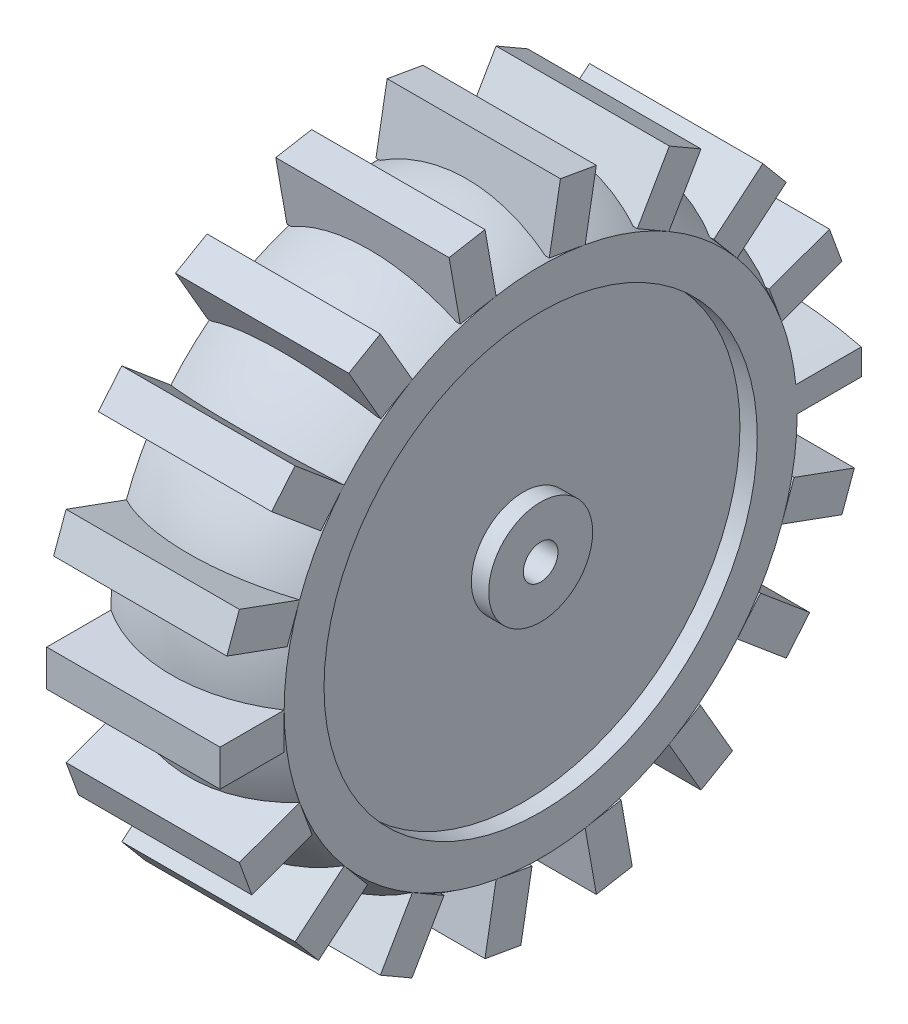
SolidWorks part; units mm, degrees
ref_plane "Front Plane" through (0, 0, 0) normal (0, 0, 1) x (1, 0, 0)
ref_plane "Top Plane" through (0, 0, 0) normal (0, 1, 0) x (1, 0, 0)
ref_plane "Right Plane" through (0, 0, 0) normal (1, 0, 0) x (0, 0, -1)
sketch "Sketch1" plane through (0, 0, 0) normal (1, 0, 0) x (0, 0, -1)
  circle A0 centre (0, 0) radius 35
  dimension "D1" = 70
extrude "Boss-Extrude1" add sketch "Sketch1" along normal blind 20
sketch "Sketch2" plane through (20, 0, 0) normal (1, 0, 0) x (0, 0, -1)
  circle A0 centre (0, 0) radius 2
  dimension "D1" = 4
extrude "Cut-Extrude1" cut sketch "Sketch2" against normal blind 20
sketch "Sketch3" plane through (0, 0, 0) normal (0, 0, 1) x (1, 0, 0)
  line L0 (20, 35) -> (0, 35) construction
  line L1 (-6.5877, 0) -> (24.1886, 0)
  line L2 (0, 35) -> (20, 35)
  arc A0 (0, 35) -> (20, 35) centre (10, 27.5) cw
  point P0 (10, 40)
  point P12 (10, 40)
  dimension "D1" = 5
revolve "Revolve1" add sketch "Sketch3" angle 360 about L1
sketch "Sketch10" plane through (0, 0, 0) normal (-1, 0, 0) x (0, 0, 1)
  circle A0 centre (0, 0) radius 25
  circle A1 centre (0, 0) radius 6
  dimension "D1" = 50
  dimension "D2" = 12
extrude "Cut-Extrude2" cut sketch "Sketch10" against normal blind 2
sketch "Sketch11" plane through (20, 0, 0) normal (1, 0, 0) x (0, 0, -1)
  circle A1 centre (0, 0) radius 6
  circle A2 centre (0, 0) radius 6
  circle A3 centre (0, 0) radius 25
  circle A4 centre (0, 0) radius 25
  dimension "D1" = 0
  dimension "D2" = 0
extrude "Cut-Extrude3" cut sketch "Sketch11" against normal blind 2
sketch "Sketch12" plane through (20, 0, 0) normal (1, 0, 0) x (0, 0, -1)
  circle A0 centre (0, 0) radius 32.6
  circle A2 centre (0, 0) radius 40
  point P4 (-32.6, 0)
  point P5 (-40, 0)
  dimension "D1" = 7.4
extrude "Cut-Extrude4" cut sketch "Sketch12" against normal blind 30
sketch "Sketch13" plane through (0, 0, 0) normal (0, 1, 0) x (1, 0, 0)
  line L0 (0, 32.6) -> (0, -32.6) construction
  line L1 (20, -32.6) -> (20, 32.6) construction
  line L2 (20, 32.6) -> (0, 32.6) construction
  line L3 (0, 29.6) -> (0, 39.0141)
  line L4 (0, 39.0141) -> (20, 39.0141)
  line L5 (20, 39.0141) -> (20, 29.6)
  line L6 (-7.8858, 0) -> (24.909, 0)
  arc A0 (0, 29.6) -> (20, 29.6) centre (10, 14.4333) cw
  point P0 (0, 29.6)
  point P1 (20, 29.6)
  point P4 (10, 32.6)
  dimension "D1" = 3
  dimension "D2" = 3
revolve "Cut-Revolve1" cut sketch "Sketch13" angle 360 about L6
ref_plane "Plane1" through (0, 0, -27) normal (0, 0, 1) x (1, 0, 0)
sketch "Sketch14" plane through (0, 0, -27) normal (0, 0, 1) x (1, 0, 0)
  line L0 (20, -29.6) -> (20, 29.6) construction
  line L1 (0, 29.6) -> (0, -29.6) construction
  line L2 (20, 0) -> (20, 3)
  line L3 (0, 0) -> (0, 3)
  arc A0 (0, 0) -> (20, 0) centre (10, -40.7922) cw
  arc A1 (0, 3) -> (20, 3) centre (10, -37.7922) cw
  point P0 (20, 0)
  point P1 (0, 0)
  point P4 (20, 3)
  point P6 (0, 3)
  dimension "D3" = 42
  dimension "D4" = 42
  dimension "D1" = 3
  dimension "D2" = 3
extrude "Boss-Extrude2" add sketch "Sketch14" against normal blind 10
sketch "Sketch15" plane through (0, 0, 0) normal (-1, 0, 0) x (0, 0, 1)
  line L0 (-37, 0) -> (-29.6, 0) construction
  line L1 (-37, 0) -> (-29.6, 0)
  line L2 (-37, 3) -> (-37, 0) construction
  line L3 (-37, 3) -> (-37, 0)
  line L4 (-37, 4.2078) -> (-37, 3) construction
  line L5 (-37, 4.2078) -> (-37, 3)
  line L6 (-32.3273, 4.2078) -> (-37, 4.2078) construction
  line L7 (-32.3273, 4.2078) -> (-37, 4.2078)
  line L8 (-29.6, 0) -> (-29.6, 4.2078)
  line L9 (-29.6, 4.2078) -> (-32.3273, 4.2078)
  line L10 (-26.3757, 14.0779) -> (-28.9385, 15.0107)
  line L11 (-33.7426, 15.4738) -> (-34.7686, 12.6547)
  line L12 (-28.9385, 15.0107) -> (-33.3295, 16.6088)
  line L13 (-33.3295, 16.6088) -> (-33.7426, 15.4738)
  line L14 (-34.7686, 12.6547) -> (-27.8149, 10.1238)
  line L15 (-27.8149, 10.1238) -> (-26.3757, 14.0779)
  line L16 (-19.9702, 22.2499) -> (-22.0594, 24.003)
  line L17 (-26.4153, 26.0813) -> (-28.3436, 23.7831)
  line L18 (-22.0594, 24.003) -> (-25.6389, 27.0065)
  line L19 (-25.6389, 27.0065) -> (-26.4153, 26.0813)
  line L20 (-28.3436, 23.7831) -> (-22.6749, 19.0265)
  line L21 (-22.6749, 19.0265) -> (-19.9702, 22.2499)
  line L22 (-11.1559, 27.7383) -> (-12.5195, 30.1002)
  line L23 (-15.9019, 33.5429) -> (-18.5, 32.0429)
  line L24 (-12.5195, 30.1002) -> (-14.8559, 34.1469)
  line L25 (-14.8559, 34.1469) -> (-15.9019, 33.5429)
  line L26 (-18.5, 32.0429) -> (-14.8, 25.6344)
  line L27 (-14.8, 25.6344) -> (-11.1559, 27.7383)
  line L28 (-0.9961, 29.881) -> (-1.4697, 32.5668)
  line L29 (-3.4706, 36.9588) -> (-6.425, 36.4379)
  line L30 (-1.4697, 32.5668) -> (-2.2811, 37.1686)
  line L31 (-2.2811, 37.1686) -> (-3.4706, 36.9588)
  line L32 (-6.425, 36.4379) -> (-5.14, 29.1503)
  line L33 (-5.14, 29.1503) -> (-0.9961, 29.881)
  line L34 (9.2839, 28.4196) -> (9.7575, 31.1055)
  line L35 (9.3794, 35.9169) -> (6.425, 36.4379)
  line L36 (9.7575, 31.1055) -> (10.5689, 35.7072)
  line L37 (10.5689, 35.7072) -> (9.3794, 35.9169)
  line L38 (6.425, 36.4379) -> (5.14, 29.1503)
  line L39 (5.14, 29.1503) -> (9.2839, 28.4196)
  line L40 (18.4441, 23.5304) -> (19.8077, 25.8923)
  line L41 (21.0981, 30.5429) -> (18.5, 32.0429)
  line L42 (19.8077, 25.8923) -> (22.1441, 29.939)
  line L43 (22.1441, 29.939) -> (21.0981, 30.5429)
  line L44 (18.5, 32.0429) -> (14.8, 25.6344)
  line L45 (14.8, 25.6344) -> (18.4441, 23.5304)
  line L46 (25.3797, 15.8031) -> (27.4689, 17.5562)
  line L47 (30.272, 21.485) -> (28.3436, 23.7831)
  line L48 (27.4689, 17.5562) -> (31.0484, 20.5597)
  line L49 (31.0484, 20.5597) -> (30.272, 21.485)
  line L50 (28.3436, 23.7831) -> (22.6749, 19.0265)
  line L51 (22.6749, 19.0265) -> (25.3797, 15.8031)
  line L52 (29.2541, 6.1697) -> (31.8169, 7.1025)
  line L53 (35.7947, 9.8357) -> (34.7686, 12.6547)
  line L54 (31.8169, 7.1025) -> (36.2078, 8.7007)
  line L55 (36.2078, 8.7007) -> (35.7947, 9.8357)
  line L56 (34.7686, 12.6547) -> (27.8149, 10.1238)
  line L57 (27.8149, 10.1238) -> (29.2541, 6.1697)
  line L58 (29.6, -4.2078) -> (32.3273, -4.2078)
  line L59 (37, -3) -> (37, 0)
  line L60 (32.3273, -4.2078) -> (37, -4.2078)
  line L61 (37, -4.2078) -> (37, -3)
  line L62 (37, 0) -> (29.6, 0)
  line L63 (29.6, 0) -> (29.6, -4.2078)
  line L64 (26.3757, -14.0779) -> (28.9385, -15.0107)
  line L65 (33.7426, -15.4738) -> (34.7686, -12.6547)
  line L66 (28.9385, -15.0107) -> (33.3295, -16.6088)
  line L67 (33.3295, -16.6088) -> (33.7426, -15.4738)
  line L68 (34.7686, -12.6547) -> (27.8149, -10.1238)
  line L69 (27.8149, -10.1238) -> (26.3757, -14.0779)
  line L70 (19.9702, -22.2499) -> (22.0594, -24.003)
  line L71 (26.4153, -26.0813) -> (28.3436, -23.7831)
  line L72 (22.0594, -24.003) -> (25.6389, -27.0065)
  line L73 (25.6389, -27.0065) -> (26.4153, -26.0813)
  line L74 (28.3436, -23.7831) -> (22.6749, -19.0265)
  line L75 (22.6749, -19.0265) -> (19.9702, -22.2499)
  line L76 (11.1559, -27.7383) -> (12.5195, -30.1002)
  line L77 (15.9019, -33.5429) -> (18.5, -32.0429)
  line L78 (12.5195, -30.1002) -> (14.8559, -34.1469)
  line L79 (14.8559, -34.1469) -> (15.9019, -33.5429)
  line L80 (18.5, -32.0429) -> (14.8, -25.6344)
  line L81 (14.8, -25.6344) -> (11.1559, -27.7383)
  line L82 (0.9961, -29.881) -> (1.4697, -32.5668)
  line L83 (3.4706, -36.9588) -> (6.425, -36.4379)
  line L84 (1.4697, -32.5668) -> (2.2811, -37.1686)
  line L85 (2.2811, -37.1686) -> (3.4706, -36.9588)
  line L86 (6.425, -36.4379) -> (5.14, -29.1503)
  line L87 (5.14, -29.1503) -> (0.9961, -29.881)
  line L88 (-9.2839, -28.4196) -> (-9.7575, -31.1055)
  line L89 (-9.3794, -35.9169) -> (-6.425, -36.4379)
  line L90 (-9.7575, -31.1055) -> (-10.5689, -35.7072)
  line L91 (-10.5689, -35.7072) -> (-9.3794, -35.9169)
  line L92 (-6.425, -36.4379) -> (-5.14, -29.1503)
  line L93 (-5.14, -29.1503) -> (-9.2839, -28.4196)
  line L94 (-18.4441, -23.5304) -> (-19.8077, -25.8923)
  line L95 (-21.0981, -30.5429) -> (-18.5, -32.0429)
  line L96 (-19.8077, -25.8923) -> (-22.1441, -29.939)
  line L97 (-22.1441, -29.939) -> (-21.0981, -30.5429)
  line L98 (-18.5, -32.0429) -> (-14.8, -25.6344)
  line L99 (-14.8, -25.6344) -> (-18.4441, -23.5304)
  line L100 (-25.3797, -15.8031) -> (-27.4689, -17.5562)
  line L101 (-30.272, -21.485) -> (-28.3436, -23.7831)
  line L102 (-27.4689, -17.5562) -> (-31.0484, -20.5597)
  line L103 (-31.0484, -20.5597) -> (-30.272, -21.485)
  line L104 (-28.3436, -23.7831) -> (-22.6749, -19.0265)
  line L105 (-22.6749, -19.0265) -> (-25.3797, -15.8031)
  line L106 (-29.2541, -6.1697) -> (-31.8169, -7.1025)
  line L107 (-35.7947, -9.8357) -> (-34.7686, -12.6547)
  line L108 (-31.8169, -7.1025) -> (-36.2078, -8.7007)
  line L109 (-36.2078, -8.7007) -> (-35.7947, -9.8357)
  line L110 (-34.7686, -12.6547) -> (-27.8149, -10.1238)
  line L111 (-27.8149, -10.1238) -> (-29.2541, -6.1697)
  point P110 (0, 0)
  dimension "D1" = 18
extrude "Boss-Extrude4" add sketch "Sketch15" against normal blind 20 contours L104 L105 L100 L102 L103 L101 | L20 L21 L16 L18 L19 L17 | L26 L27 L22 L24 L25 L23 | L32 L33 L28 L30 L31 L29 | L38 L39 L34 L36 L37 L35 | L44 L45 L40 L42 L43 L41 | L50 L51 L46 L48 L49 L47 | L62 L63 L58 L60 L61 L59 | L68 L69 L64 L66 L67 L65 | L74 L75 L70 L72 L73 L71 | L86 L87 L82 L84 L85 L83 | L92 L93 L88 L90 L91 L89 | L98 L99 L94 L96 L97 L95 | L108 L109 L107 L110 L111 L106 | L14 L15 L10 L12 L13 L11 | L53 L56 L57 L52 L54 L55 | L77 L80 L81 L76 L78 L79
sketch "Sketch17" plane through (0, 12.6547, -34.7686) normal (0, 0.342, -0.9397) x (-1, 0, 0)
  line L0 (-20, 4.2078) -> (-20, 0) construction
  line L1 (0, 4.2078) -> (0, 0) construction
  line L2 (-20, 3) -> (-20, 6.8749)
  line L3 (-20, 10.1238) -> (-20, 0) construction
  line L4 (-20, 6.8749) -> (0, 6.8749)
  line L5 (0, 0) -> (0, 10.1238) construction
  line L6 (0, 6.8749) -> (0, 3)
  line L7 (0, 0) -> (0, -3.0573)
  line L8 (0, -7.2526) -> (0, 0) construction
  line L9 (0, -3.0573) -> (-20, -3.0573)
  line L10 (-20, 0) -> (-20, -7.2526) construction
  line L11 (-20, -3.0573) -> (-20, 0)
  arc A0 (-20, 0) -> (0, 0) centre (-10, -40.7922) cw
  arc A1 (-20, 3) -> (0, 3) centre (-10, -37.7922) cw
  point P0 (-20, 0)
  point P1 (-20, 3)
  point P3 (0, 3)
  point P6 (0, 0)
  dimension "D3" = 42
  dimension "D4" = 42
  dimension "D1" = 3
  dimension "D2" = 3
sketch "Sketch18" plane through (0, 23.7831, -28.3436) normal (0, 0.6428, -0.766) x (-1, 0, 0)
  line L0 (-20, 4.2078) -> (-20, 0) construction
  line L1 (0, 4.2078) -> (0, 0) construction
  line L2 (0, 3) -> (0, 6.4455)
  line L3 (0, 0) -> (0, 10.1238) construction
  line L4 (0, 6.4455) -> (-20, 6.4455)
  line L5 (-20, 10.1238) -> (-20, 0) construction
  line L6 (-20, 6.4455) -> (-20, 3)
  line L7 (0, 0) -> (0, -4.2078)
  line L8 (0, -4.2078) -> (-20, -4.2078)
  line L9 (-20, -4.2078) -> (-20, 0)
  arc A0 (-20, 0) -> (0, 0) centre (-10, -40.7922) cw
  arc A1 (-20, 3) -> (0, 3) centre (-10, -37.7922) cw
  point P0 (-20, 0)
  point P1 (-20, 3)
  point P3 (0, 3)
  point P6 (0, 0)
  dimension "D3" = 42
  dimension "D4" = 42
  dimension "D1" = 3
  dimension "D2" = 3
sketch "Sketch19" plane through (0, 32.0429, -18.5) normal (0, 0.866, -0.5) x (1, 0, 0)
  line L0 (20, -4.2078) -> (20, 0) construction
  line L1 (0, -4.2078) -> (0, 0) construction
  line L2 (20, 0) -> (20, 2.3738)
  line L3 (20, 0) -> (20, 10.1238) construction
  line L4 (20, 2.3738) -> (0, 2.3738)
  line L5 (0, 10.1238) -> (0, 0) construction
  line L6 (0, 2.3738) -> (0, 0)
  line L7 (20, -3) -> (20, -6.7583)
  line L8 (20, -10.1238) -> (20, 0) construction
  line L9 (20, -6.7583) -> (0, -6.7583)
  line L10 (0, 0) -> (0, -10.1238) construction
  line L11 (0, -6.7583) -> (0, -3)
  arc A0 (20, 0) -> (0, 0) centre (10, 40.7922) cw
  arc A1 (20, -3) -> (0, -3) centre (10, 37.7922) cw
  point P0 (20, 0)
  point P1 (20, -3)
  point P3 (0, -3)
  point P6 (0, 0)
  point P9 (20, 0)
  point P11 (20, -3)
  dimension "D3" = 42
  dimension "D1" = 3
  dimension "D2" = 3
sketch "Sketch20" plane through (0, 36.4379, -6.425) normal (0, 0.9848, -0.1736) x (1, 0, 0)
  line L0 (20, -4.2078) -> (20, 0) construction
  line L1 (0, -4.2078) -> (0, 0) construction
  line L2 (20, 0) -> (20, 2.6448)
  line L3 (20, 0) -> (20, 10.1238) construction
  line L4 (20, 2.6448) -> (0, 2.6448)
  line L5 (0, 10.1238) -> (0, 0) construction
  line L6 (0, 2.6448) -> (0, 0)
  line L7 (20, -3) -> (20, -6.4621)
  line L8 (20, -10.1238) -> (20, 0) construction
  line L9 (20, -6.4621) -> (0, -6.4621)
  line L10 (0, 0) -> (0, -10.1238) construction
  line L11 (0, -6.4621) -> (0, -3)
  arc A0 (20, 0) -> (0, 0) centre (10, 40.7922) cw
  arc A1 (20, -3) -> (0, -3) centre (10, 37.7922) cw
  point P0 (20, 0)
  point P1 (20, -3)
  point P3 (0, -3)
  point P6 (0, 0)
  dimension "D3" = 42
  dimension "D1" = 3
  dimension "D2" = 3
sketch "Sketch21" plane through (0, 36.4379, 6.425) normal (0, 0.9848, 0.1736) x (1, 0, 0)
  line L0 (20, -4.2078) -> (20, 0) construction
  line L1 (0, -4.2078) -> (0, 0) construction
  line L2 (0, 0) -> (0, 3.4595)
  line L3 (0, 10.1238) -> (0, 0) construction
  line L4 (0, 3.4595) -> (20, 3.4595)
  line L5 (20, 0) -> (20, 10.1238) construction
  line L6 (20, 3.4595) -> (20, 0)
  line L7 (20, -3) -> (20, -6.9355)
  line L8 (20, -10.1238) -> (20, 0) construction
  line L9 (20, -6.9355) -> (0, -6.9355)
  line L10 (0, 0) -> (0, -10.1238) construction
  line L11 (0, -6.9355) -> (0, -3)
  arc A0 (20, 0) -> (0, 0) centre (10, 40.7922) cw
  arc A1 (20, -3) -> (0, -3) centre (10, 37.7922) cw
  point P0 (20, 0)
  point P1 (20, -3)
  point P3 (0, 0)
  point P6 (0, -3)
  dimension "D3" = 42
  dimension "D1" = 3
  dimension "D2" = 3
sketch "Sketch22" plane through (0, 32.0429, 18.5) normal (0, 0.866, 0.5) x (1, 0, 0)
  line L0 (20, -4.2078) -> (20, 0) construction
  line L1 (0, -4.2078) -> (0, 0) construction
  line L2 (0, 0) -> (0, 3.4697)
  line L3 (0, 10.1238) -> (0, 0) construction
  line L4 (0, 3.4697) -> (20, 3.4697)
  line L5 (20, 0) -> (20, 10.1238) construction
  line L6 (20, 3.4697) -> (20, 0)
  line L7 (20, -3) -> (20, -7.5879)
  line L8 (20, -10.1238) -> (20, 0) construction
  line L9 (20, -7.5879) -> (0, -7.5879)
  line L10 (0, 0) -> (0, -10.1238) construction
  line L11 (0, -7.5879) -> (0, -3)
  arc A0 (20, 0) -> (0, 0) centre (10, 40.7922) cw
  arc A1 (20, -3) -> (0, -3) centre (10, 37.7922) cw
  point P0 (20, 0)
  point P1 (20, -3)
  point P3 (0, -3)
  point P6 (0, 0)
  dimension "D3" = 42
  dimension "D1" = 3
  dimension "D2" = 3
sketch "Sketch23" plane through (0, 23.7831, 28.3436) normal (0, 0.6428, 0.766) x (1, 0, 0)
  line L0 (20, -4.2078) -> (20, 0) construction
  line L1 (0, -4.2078) -> (0, 0) construction
  line L2 (20, 0) -> (20, 2.5294)
  line L3 (20, 0) -> (20, 10.1238) construction
  line L4 (20, 2.5294) -> (0, 2.5294)
  line L5 (0, 10.1238) -> (0, 0) construction
  line L6 (0, 2.5294) -> (0, 0)
  line L7 (20, -3) -> (20, -5.9017)
  line L8 (20, -10.1238) -> (20, 0) construction
  line L9 (20, -5.9017) -> (0, -5.9017)
  line L10 (0, 0) -> (0, -10.1238) construction
  line L11 (0, -5.9017) -> (0, -3)
  arc A0 (20, 0) -> (0, 0) centre (10, 40.7922) cw
  arc A1 (20, -3) -> (0, -3) centre (10, 37.7922) cw
  point P0 (20, 0)
  point P1 (20, -3)
  point P3 (0, -3)
  point P6 (0, 0)
  dimension "D3" = 42
  dimension "D1" = 3
  dimension "D2" = 3
sketch "Sketch24" plane through (0, 12.6547, 34.7686) normal (0, 0.342, 0.9397) x (1, 0, 0)
  line L0 (20, -4.2078) -> (20, 0) construction
  line L1 (0, -4.2078) -> (0, 0) construction
  line L2 (20, 0) -> (20, 4.2078)
  line L3 (20, 4.2078) -> (0, 4.2078)
  line L4 (0, 10.1238) -> (0, 0) construction
  line L5 (0, 4.2078) -> (0, 0)
  line L6 (20, -3) -> (20, -7.2272)
  line L7 (20, -10.1238) -> (20, 0) construction
  line L8 (20, -7.2272) -> (0, -7.2272)
  line L9 (0, 0) -> (0, -10.1238) construction
  line L10 (0, -7.2272) -> (0, -3)
  arc A0 (20, 0) -> (0, 0) centre (10, 40.7922) cw
  arc A1 (20, -3) -> (0, -3) centre (10, 37.7922) cw
  point P0 (20, 0)
  point P1 (20, -3)
  point P3 (0, -3)
  point P6 (0, 0)
  dimension "D3" = 42
  dimension "D1" = 3
  dimension "D2" = 3
sketch "Sketch25" plane through (0, 0, 37) normal (0, 0, 1) x (1, 0, 0)
  line L0 (20, -4.2078) -> (20, 0) construction
  line L1 (0, -4.2078) -> (0, 0) construction
  line L2 (0, 0) -> (0, 5.0619)
  line L3 (0, 10.1238) -> (0, 0) construction
  line L4 (0, 5.0619) -> (20, 5.0619)
  line L5 (20, 0) -> (20, 10.1238) construction
  line L6 (20, 5.0619) -> (20, 0)
  line L7 (20, -3) -> (20, -6.8479)
  line L8 (20, -10.1238) -> (20, 0) construction
  line L9 (20, -6.8479) -> (0, -6.8479)
  line L10 (0, 0) -> (0, -10.1238) construction
  line L11 (0, -6.8479) -> (0, -3)
  arc A0 (20, 0) -> (0, 0) centre (10, 40.7922) cw
  arc A1 (20, -3) -> (0, -3) centre (10, 37.7922) cw
  point P0 (20, 0)
  point P1 (20, -3)
  point P3 (0, 0)
  point P6 (0, -3)
  dimension "D3" = 42
  dimension "D1" = 3
  dimension "D2" = 3
sketch "Sketch26" plane through (0, -12.6547, 34.7686) normal (0, -0.342, 0.9397) x (1, 0, 0)
  line L0 (20, -4.2078) -> (20, 0) construction
  line L1 (0, -4.2078) -> (0, 0) construction
  line L2 (20, 0) -> (20, 3.5074)
  line L3 (20, 0) -> (20, 10.1238) construction
  line L4 (20, 3.5074) -> (0, 3.5074)
  line L5 (0, 10.1238) -> (0, 0) construction
  line L6 (0, 3.5074) -> (0, 0)
  line L7 (20, -3) -> (20, -5.7086)
  line L8 (20, -10.1238) -> (20, 0) construction
  line L9 (20, -5.7086) -> (0, -5.7086)
  line L10 (0, 0) -> (0, -10.1238) construction
  line L11 (0, -5.7086) -> (0, -3)
  arc A0 (20, 0) -> (0, 0) centre (10, 40.7922) cw
  arc A1 (20, -3) -> (0, -3) centre (10, 37.7922) cw
  point P0 (20, 0)
  point P1 (20, -3)
  point P3 (0, -3)
  point P6 (0, 0)
  dimension "D3" = 42
  dimension "D1" = 3
  dimension "D2" = 3
sketch "Sketch29" plane through (0, -36.4379, 6.425) normal (0, -0.9848, 0.1736) x (1, 0, 0)
  line L0 (20, -4.2078) -> (20, 0) construction
  line L1 (0, -4.2078) -> (0, 0) construction
  line L2 (0, 0) -> (0, 2.7282)
  line L3 (0, 10.1238) -> (0, 0) construction
  line L4 (0, 2.7282) -> (20, 2.7282)
  line L5 (20, 0) -> (20, 10.1238) construction
  line L6 (20, 2.7282) -> (20, 0)
  line L7 (20, -3) -> (20, -6.4018)
  line L8 (20, -10.1238) -> (20, 0) construction
  line L9 (20, -6.4018) -> (0, -6.4018)
  line L10 (0, 0) -> (0, -10.1238) construction
  line L11 (0, -6.4018) -> (0, -3)
  arc A0 (20, 0) -> (0, 0) centre (10, 44.7555) cw
  arc A1 (20, -3) -> (0, -3) centre (10, 37.7922) cw
  point P0 (20, 0)
  point P1 (20, -3)
  point P3 (0, 0)
  point P6 (0, -3)
  dimension "D1" = 3
  dimension "D2" = 3
sketch "Sketch30" plane through (0, -36.4379, -6.425) normal (0, -0.9848, -0.1736) x (1, 0, 0)
  line L0 (20, -4.2078) -> (20, 0) construction
  line L1 (0, -4.2078) -> (0, 0) construction
  line L2 (20, 0) -> (20, 3.8245)
  line L3 (20, 0) -> (20, 10.1238) construction
  line L4 (20, 3.8245) -> (0, 3.8245)
  line L5 (0, 10.1238) -> (0, 0) construction
  line L6 (0, 3.8245) -> (0, 0)
  line L7 (20, -3) -> (20, -6.3756)
  line L8 (20, -10.1238) -> (20, 0) construction
  line L9 (20, -6.3756) -> (0, -6.3756)
  line L10 (0, 0) -> (0, -10.1238) construction
  line L11 (0, -6.3756) -> (0, -3)
  arc A0 (20, 0) -> (0, 0) centre (10, 40.7922) cw
  arc A1 (20, -3) -> (0, -3) centre (10, 37.7922) cw
  point P0 (20, 0)
  point P1 (20, -3)
  point P3 (0, -3)
  point P6 (0, 0)
  dimension "D3" = 42
  dimension "D1" = 3
  dimension "D2" = 3
sketch "Sketch31" plane through (0, -32.0429, -18.5) normal (0, -0.866, -0.5) x (1, 0, 0)
  line L0 (20, -4.2078) -> (20, 0) construction
  line L1 (0, -4.2078) -> (0, 0) construction
  line L2 (0, 0) -> (0, 3.8817)
  line L3 (0, 10.1238) -> (0, 0) construction
  line L4 (0, 3.8817) -> (20, 3.8817)
  line L5 (20, 0) -> (20, 10.1238) construction
  line L6 (20, 3.8817) -> (20, 0)
  line L7 (20, -3) -> (20, -6.5708)
  line L8 (20, -10.1238) -> (20, 0) construction
  line L9 (20, -6.5708) -> (0, -6.5708)
  line L10 (0, 0) -> (0, -10.1238) construction
  line L11 (0, -6.5708) -> (0, -3)
  arc A0 (20, 0) -> (0, 0) centre (10, 40.7922) cw
  arc A1 (20, -3) -> (0, -3) centre (10, 37.7922) cw
  point P0 (20, 0)
  point P1 (20, -3)
  point P3 (0, 0)
  point P6 (0, -3)
  dimension "D3" = 42
  dimension "D1" = 3
  dimension "D2" = 3
sketch "Sketch32" plane through (0, -23.7831, -28.3436) normal (0, -0.6428, -0.766) x (-1, 0, 0)
  line L0 (0, 4.2078) -> (0, 0) construction
  line L1 (-20, 4.2078) -> (-20, 0) construction
  line L2 (-20, 3) -> (-20, 6.6294)
  line L3 (-20, 10.1238) -> (-20, 0) construction
  line L4 (-20, 6.6294) -> (0, 6.6294)
  line L5 (0, 0) -> (0, 10.1238) construction
  line L6 (0, 6.6294) -> (0, 3)
  line L7 (0, 0) -> (0, -2.9911)
  line L8 (0, -10.1238) -> (0, 0) construction
  line L9 (0, -2.9911) -> (-20, -2.9911)
  line L10 (-20, 0) -> (-20, -10.1238) construction
  line L11 (-20, -2.9911) -> (-20, 0)
  arc A0 (-20, 0) -> (0, 0) centre (-10, -40.7922) cw
  arc A1 (-20, 3) -> (0, 3) centre (-10, -37.7922) cw
  point P0 (-20, 0)
  point P1 (0, 0)
  point P3 (0, 3)
  point P5 (-20, 3)
  dimension "D3" = 42
  dimension "D1" = 3
  dimension "D2" = 3
sketch "Sketch34" plane through (0, 0, 0) normal (0, 1, 0) x (1, 0, 0)
  line L0 (20, 37) -> (20, 29.6) construction
  line L1 (0, 37) -> (0, 29.6) construction
  line L2 (20, 32.6) -> (20, 40.0185)
  line L3 (20, 40.0185) -> (0, 40.0185)
  line L4 (0, 29.6) -> (0, 27.8149)
  line L5 (20, 27.8149) -> (20, 29.6)
  line L8 (0, 40.0185) -> (0, 32.6)
  line L9 (-7.3871, 0) -> (38.3068, 0)
  arc A0 (0, 32.6) -> (20, 32.6) centre (10, 17.2739) cw
  arc A1 (0, 29.6) -> (20, 29.6) centre (10, 14.2739) cw
  spline S0 degree 3 poles (-156.2824, -954.7394) (16.1717, -190.6131) (62.334, 10.0788) (16.9241, 31.2451) (16.1052, 31.5571) (14.8319, 31.9377) (14.3989, 32.05) (13.5328, 32.2413) (13.0978, 32.3208) (11.7874, 32.5121) (10.9063, 32.5768) (9.5734, 32.578) (9.1258, 32.5623) (8.2332, 32.4983) (7.791, 32.4502) (6.4767, 32.2594) (5.6165, 32.0702) (3.9279, 31.5685) (3.0943, 31.253) (-50.5025, 6.3147) (39.1186, -262.8264) (92.4138, -966.1125) knots -6.931583 -6.931583 -6.931583 -6.931583 0.125 0.125 0.25 0.25 0.3125 0.3125 0.375 0.375 0.5 0.5 0.5625 0.5625 0.625 0.625 0.75 0.75 0.875 0.875 9.147508 9.147508 9.147508 9.147508 only from (20, 29.6) to (0, 29.6) construction
  spline S1 degree 3 poles (20, 29.6) (19.2668, 30.0834) (18.5049, 30.5083) (16.9241, 31.2451) (16.1052, 31.5571) (14.8319, 31.9377) (14.3989, 32.05) (13.5328, 32.2413) (13.0978, 32.3208) (11.7874, 32.5121) (10.9063, 32.5768) (9.5734, 32.578) (9.1258, 32.5623) (8.2332, 32.4983) (7.791, 32.4502) (6.4767, 32.2594) (5.6165, 32.0702) (3.9279, 31.5685) (3.0943, 31.253) (1.4987, 30.5106) (0.7334, 30.0836) (0, 29.6) knots 0 0 0 0 0.125 0.125 0.25 0.25 0.3125 0.3125 0.375 0.375 0.5 0.5 0.5625 0.5625 0.625 0.625 0.75 0.75 0.875 0.875 1 1 1 1
  spline S6 degree 3 poles (-999.2158, -11.7736) (1297.9645, -57.2699) (-1214.4903, 79.6691) (1000.4109, 37.2938) knots -53.18941 -53.18941 -53.18941 -53.18941 32.55316 32.55316 32.55316 32.55316 only from (0, 27.8149) to (0.4667, 29.2541)
  spline S7 degree 3 poles (-374.294, -1930.6166) (-25.1095, -345.8257) (77.3294, 3.0892) (16.9241, 31.2451) (16.1052, 31.5571) (14.8319, 31.9377) (14.3989, 32.05) (13.5328, 32.2413) (13.0978, 32.3208) (11.7874, 32.5121) (10.9063, 32.5768) (9.5734, 32.578) (9.1258, 32.5623) (8.2332, 32.4983) (7.791, 32.4502) (6.4767, 32.2594) (5.6165, 32.0702) (3.9279, 31.5685) (3.0943, 31.253) (-70.5513, -3.014) (127.7159, -502.4882) (127.626, -1965.4448) knots -9.303112 -9.303112 -9.303112 -9.303112 0.125 0.125 0.25 0.25 0.3125 0.3125 0.375 0.375 0.5 0.5 0.5625 0.5625 0.625 0.625 0.75 0.75 0.875 0.875 12.288753 12.288753 12.288753 12.288753 only from (20, 29.6) to (0, 29.6)
  spline S8 degree 3 poles (-980.4343, 37.2933) (1234.5047, 79.67) (-1277.9652, -57.2697) (1019.2057, -11.7738) knots -31.553462 -31.553462 -31.553462 -31.553462 54.189283 54.189283 54.189283 54.189283 only from (19.5333, 29.2541) to (20, 27.8149)
  spline S9 degree 3 poles (239.7573, -941.6932) (-0.767, -244.7877) (-51.3417, 15.971) (5.8382, 31.3778) (6.6688, 31.5435) (8.324, 31.7618) (9.1546, 31.8164) (10.4048, 31.8171) (10.8223, 31.8038) (11.6588, 31.7496) (12.0794, 31.7084) (13.3297, 31.544) (14.9632, 31.2179) (16.5318, 30.6849) (17.6834, 30.2057) (18.0639, 30.0322) (72.6732, 2.864) (-24.4944, -280.8674) (-325.0456, -909.4926) knots -8.503578 -8.503578 -8.503578 -8.503578 0.25 0.25 0.375 0.375 0.5 0.5 0.5625 0.5625 0.625 0.625 0.75 0.875 0.875 0.9375 0.9375 10.03184 10.03184 10.03184 10.03184 only from (0.4667, 29.2541) to (19.5333, 29.2541)
  spline S10 degree 3 poles (0.4667, 29.2541) (1.9003, 30.0929) (3.4231, 30.727) (5.8382, 31.3778) (6.6688, 31.5435) (8.324, 31.7618) (9.1546, 31.8164) (10.4048, 31.8171) (10.8223, 31.8038) (11.6588, 31.7496) (12.0794, 31.7084) (13.3297, 31.544) (14.9632, 31.2179) (16.5318, 30.6849) (17.6834, 30.2057) (18.0639, 30.0322) (18.8093, 29.6613) (19.1749, 29.4638) (19.5333, 29.2541) knots 0 0 0 0 0.25 0.25 0.375 0.375 0.5 0.5 0.5625 0.5625 0.625 0.625 0.75 0.875 0.875 0.9375 0.9375 1 1 1 1
  spline S11 degree 3 poles (20, 29.6) (19.2668, 30.0834) (18.5049, 30.5083) (16.9241, 31.2451) (16.1052, 31.5571) (14.8319, 31.9377) (14.3989, 32.05) (13.5328, 32.2413) (13.0978, 32.3208) (11.7874, 32.5121) (10.9063, 32.5768) (9.5734, 32.578) (9.1258, 32.5623) (8.2332, 32.4983) (7.791, 32.4502) (6.4767, 32.2594) (5.6165, 32.0702) (3.9279, 31.5685) (3.0943, 31.253) (1.4987, 30.5106) (0.7334, 30.0836) (0, 29.6) knots 0 0 0 0 0.125 0.125 0.25 0.25 0.3125 0.3125 0.375 0.375 0.5 0.5 0.5625 0.5625 0.625 0.625 0.75 0.75 0.875 0.875 1 1 1 1
  point P2 (20, 32.6)
  point P3 (0, 32.6)
  point P11 (20, 29.6)
  point P12 (0, 29.6)
  point P14 (10, 34.8858)
  dimension "D3" = 0
  dimension "D4" = 18.3
  dimension "D5" = 18.3
  dimension "D1" = 3
  dimension "D2" = 3
revolve "Cut-Revolve2" cut sketch "Sketch34" angle 360 about L9
sketch "Sketch35" plane through (2, 0, 0) normal (-1, 0, 0) x (0, 0, 1)
  line L12 (0, -25) -> (-2.7416, -8.8786)
  line L13 (-23.5602, -8.3616) -> (-7.3556, -5.6058)
  line L14 (-4.268, -24.3612) -> (-6.0799, -13.7068)
  line L15 (-10.6939, -10.4341) -> (-21.4736, -12.2673)
  line L19 (-3.5715, 9.4264) -> (-14.6959, 20.2245)
  line L20 (3.4419, 9.4738) -> (14.4199, 20.4222)
  line L21 (-13.0958, 7.1995) -> (-17.9035, 17.0592)
  line L22 (7.7226, 6.202) -> (14.4199, 20.4222)
  line L23 (9.8981, -0.3429) -> (23.7767, -7.7247)
  line L24 (-14.7093, 1.9719) -> (-24.4642, -3.5921)
  line L25 (2.7126, 14.7933) -> (10.3843, 22.4442)
  line L26 (-2.898, 14.7553) -> (-10.6772, 22.3063)
  line L27 (12.923, 7.1952) -> (17.6784, 17.2923)
  line L28 (23.7767, -7.7247) -> (8.3191, -5.5334)
  line L29 (2.6921, -9.6218) -> (0, -25)
  line L30 (14.6634, 1.9593) -> (24.5113, -3.2786)
  line L31 (10.8633, -10.2184) -> (21.7535, -11.7622)
  line L34 (6.3618, -13.489) -> (4.4651, -24.3234)
  line L35 (-7.7732, 6.0272) -> (-14.6959, 20.2245)
  line L36 (-9.7902, -0.5075) -> (-23.5602, -8.3616)
  arc A0 (-18.2291, 17.1085) -> (-24.7614, -3.4459) centre (0, 0) ccw
  arc A1 (-18.0298, 17.3183) -> (-24.7191, -3.7375) centre (0, 0) ccw
  circle A2 centre (0, 0) radius 25 construction
  circle A3 centre (0, 0) radius 6 construction
  circle A4 centre (0, 0) radius 25 construction
  circle A5 centre (0, 0) radius 6 construction
  arc A7 (-9.7902, -0.5075) -> (-7.7732, 6.0272) centre (-12.2674, 3.8357) ccw
  arc A9 (2.6921, -9.6218) -> (8.3191, -5.5334) centre (7.6173, -10.484) cw
  arc A10 (9.8981, -0.3429) -> (7.7226, 6.202) centre (12.2461, 4.0716) cw
  arc A11 (-3.5715, 9.4264) -> (3.4419, 9.4738) centre (-0.0889, 13.0142) ccw
  arc A12 (12.923, 7.1952) -> (14.6634, 1.9593) centre (16.5417, 5.4908) ccw
  arc A13 (-13.0958, 7.1995) -> (-14.7093, 1.9719) centre (-16.6911, 5.4464) cw
  arc A14 (-2.7416, -8.8786) -> (-7.3556, -5.6058) centre (-6.685, -9.5492) ccw
  arc A15 (10.8633, -10.2184) -> (6.3618, -13.489) centre (10.3019, -14.1788) ccw
  arc A16 (2.7126, 14.7933) -> (-2.898, 14.7553) centre (-0.112, 17.6255) cw
  arc A18 (-21.613, -12.565) -> (-4.5012, -24.5914) centre (0, 0) ccw
  arc A19 (10.3257, 22.768) -> (-10.6229, 22.6308) centre (0, 0) ccw
  arc A20 (10.5879, 22.6472) -> (-10.8836, 22.5066) centre (0, 0) ccw
  arc A21 (24.8037, -3.1271) -> (18.0034, 17.3458) centre (0, 0) ccw
  arc A22 (24.7658, -3.414) -> (17.8013, 17.5532) centre (0, 0) ccw
  arc A23 (4.6997, -24.5543) -> (21.9006, -12.0567) centre (0, 0) ccw
  arc A24 (4.4155, -24.607) -> (22.0386, -11.8026) centre (0, 0) ccw
  arc A25 (-6.0799, -13.7068) -> (-10.6939, -10.4341) centre (-10.0233, -14.3774) ccw
  arc A26 (-24.4642, -3.5921) -> (-24.7614, -3.4459) centre (-24.5633, -3.4184) cw
  arc A27 (-17.9035, 17.0592) -> (-18.2291, 17.1085) centre (-18.0833, 16.9716) ccw
  arc A28 (-10.6772, 22.3063) -> (-10.6229, 22.6308) centre (-10.5379, 22.4498) cw
  arc A29 (10.3843, 22.4442) -> (10.3257, 22.768) centre (10.2431, 22.5858) ccw
  arc A30 (17.6784, 17.2923) -> (18.0034, 17.3458) centre (17.8594, 17.207) cw
  arc A31 (24.5113, -3.2786) -> (24.8037, -3.1271) centre (24.6052, -3.1021) ccw
  arc A32 (21.7535, -11.7622) -> (21.9006, -12.0567) centre (21.7254, -11.9602) cw
  arc A33 (4.4651, -24.3234) -> (4.6997, -24.5543) centre (4.6621, -24.3578) ccw
  arc A34 (-21.613, -12.565) -> (-21.4736, -12.2673) centre (-21.4401, -12.4644) cw
  arc A35 (-4.5012, -24.5914) -> (-4.268, -24.3612) centre (-4.4652, -24.3947) ccw
  point P40 (-5.719, 1.8145)
  point P43 (0, -6)
  point P46 (3.5268, -4.854)
  point P49 (5.6934, 1.8935)
  point P52 (-0.0415, 5.9999)
  point P60 (-11.4525, 3.8295)
  point P61 (-0.0551, 8.0142)
  point P62 (7.5013, 2.4944)
  point P63 (4.6783, -6.4389)
  point P65 (-7.4898, 2.3611)
  point P83 (-11.4525, 3.8295)
  point P93 (-21.7562, -12.3153)
  point P96 (-4.2204, -24.6412)
  dimension "D1" = 4
  dimension "D2" = 4
  dimension "D3" = 4
  dimension "D4" = 0.2
  dimension "D5" = 0.2
extrude "Cut-Extrude22" cut sketch "Sketch35" against normal blind 20 contours L14 A25 L15 A34 A18 A35 | L30 A31 A21 A30 L27 A12 | L31 A32 A23 A33 L34 A15 | L25 A29 A19 A28 L26 A16 | L21 A27 A0 A26 L24 A13
sketch "Sketch36" plane through (0, 0, 0) normal (-1, 0, 0) x (0, 0, 1)
  line L2 (17.6784, 17.2923) -> (12.923, 7.1952)
  line L3 (14.6634, 1.9593) -> (24.5113, -3.2786)
  line L6 (21.7535, -11.7622) -> (10.8633, -10.2184)
  line L7 (6.3618, -13.489) -> (4.4651, -24.3234)
  line L10 (-3.5715, 9.4264) -> (-14.6959, 20.2245)
  line L11 (-14.6959, 20.2245) -> (-7.7732, 6.0272)
  line L12 (-9.7902, -0.5075) -> (-23.5602, -8.3616)
  line L13 (-23.5602, -8.3616) -> (-7.3556, -5.6058)
  line L14 (-2.7416, -8.8786) -> (0, -25)
  line L15 (0, -25) -> (2.6921, -9.6218)
  line L16 (8.3191, -5.5334) -> (23.7767, -7.7247)
  line L17 (23.7767, -7.7247) -> (9.8981, -0.3429)
  line L18 (7.7226, 6.202) -> (14.4199, 20.4222)
  line L19 (14.4199, 20.4222) -> (3.4419, 9.4738)
  line L20 (-3.5715, 9.4264) -> (-14.6959, 20.2245)
  line L21 (-14.6959, 20.2245) -> (-7.7732, 6.0272)
  line L22 (-9.7902, -0.5075) -> (-23.5602, -8.3616)
  line L23 (-23.5602, -8.3616) -> (-7.3556, -5.6058)
  line L24 (-2.7416, -8.8786) -> (0, -25)
  line L25 (0, -25) -> (2.6921, -9.6218)
  line L26 (8.3191, -5.5334) -> (23.7767, -7.7247)
  line L27 (23.7767, -7.7247) -> (9.8981, -0.3429)
  line L28 (7.7226, 6.202) -> (14.4199, 20.4222)
  line L29 (14.4199, 20.4222) -> (3.4419, 9.4738)
  line L30 (2.7126, 14.7933) -> (10.3843, 22.4442)
  line L31 (-10.6772, 22.3063) -> (-2.898, 14.7553)
  line L34 (-24.4642, -3.5921) -> (-14.7093, 1.9719)
  line L35 (-13.0958, 7.1995) -> (-17.9035, 17.0592)
  line L38 (-4.268, -24.3612) -> (-6.0799, -13.7068)
  line L39 (-10.6939, -10.4341) -> (-21.4736, -12.2673)
  arc A0 (-18.0298, 17.3183) -> (-24.7191, -3.7375) centre (0, 0) ccw construction
  arc A1 (4.4155, -24.607) -> (22.0386, -11.8026) centre (0, 0) ccw construction
  arc A2 (24.7658, -3.414) -> (17.8013, 17.5532) centre (0, 0) ccw construction
  arc A3 (10.5879, 22.6472) -> (-10.8836, 22.5066) centre (0, 0) ccw construction
  arc A4 (12.923, 7.1952) -> (14.6634, 1.9593) centre (16.5417, 5.4908) ccw
  arc A5 (-9.7902, -0.5075) -> (-7.7732, 6.0272) centre (-12.2674, 3.8357) ccw
  arc A6 (-2.7416, -8.8786) -> (-7.3556, -5.6058) centre (-6.685, -9.5492) ccw
  arc A7 (8.3191, -5.5334) -> (2.6921, -9.6218) centre (7.6173, -10.484) ccw
  arc A8 (7.7226, 6.202) -> (9.8981, -0.3429) centre (12.2461, 4.0716) ccw
  arc A9 (-3.5715, 9.4264) -> (3.4419, 9.4738) centre (-0.0889, 13.0142) ccw
  arc A10 (-9.7902, -0.5075) -> (-7.9389, 1.3328) centre (-12.2674, 3.8357) ccw
  arc A11 (-2.7416, -8.8786) -> (-3.3701, -7.3106) centre (-6.685, -9.5492) ccw
  arc A12 (8.3191, -5.5334) -> (5.3162, -6.0449) centre (7.6173, -10.484) ccw
  arc A13 (7.7226, 6.202) -> (7.2892, 3.4162) centre (12.2461, 4.0716) ccw
  arc A14 (-3.5715, 9.4264) -> (-0.5232, 8.033) centre (-0.0889, 13.0142) ccw
  arc A15 (18.0034, 17.3458) -> (17.6784, 17.2923) centre (17.8594, 17.207) ccw
  arc A16 (24.8037, -3.1271) -> (18.0034, 17.3458) centre (0, 0) ccw
  arc A17 (24.5113, -3.2786) -> (24.8037, -3.1271) centre (24.6052, -3.1021) ccw
  arc A19 (18.0034, 17.3458) -> (17.6784, 17.2923) centre (17.8594, 17.207) ccw
  arc A20 (24.8037, -3.1271) -> (18.0034, 17.3458) centre (0, 0) ccw
  arc A21 (24.5113, -3.2786) -> (24.8037, -3.1271) centre (24.6052, -3.1021) ccw
  arc A22 (21.9006, -12.0567) -> (21.7535, -11.7622) centre (21.7254, -11.9602) ccw
  arc A23 (4.6997, -24.5543) -> (21.9006, -12.0567) centre (0, 0) ccw
  arc A24 (4.4651, -24.3234) -> (4.6997, -24.5543) centre (4.6621, -24.3578) ccw
  arc A25 (10.8633, -10.2184) -> (6.3618, -13.489) centre (10.3019, -14.1788) ccw
  arc A26 (21.9006, -12.0567) -> (21.7535, -11.7622) centre (21.7254, -11.9602) ccw
  arc A27 (4.6997, -24.5543) -> (21.9006, -12.0567) centre (0, 0) ccw
  arc A28 (4.4651, -24.3234) -> (4.6997, -24.5543) centre (4.6621, -24.3578) ccw
  arc A30 (10.3843, 22.4442) -> (10.3257, 22.768) centre (10.2431, 22.5858) ccw
  arc A31 (10.3257, 22.768) -> (-10.6229, 22.6308) centre (0, 0) ccw
  arc A32 (-10.6229, 22.6308) -> (-10.6772, 22.3063) centre (-10.5379, 22.4498) ccw
  arc A33 (-2.898, 14.7553) -> (2.7126, 14.7933) centre (-0.112, 17.6255) ccw
  arc A34 (10.3843, 22.4442) -> (10.3257, 22.768) centre (10.2431, 22.5858) ccw
  arc A36 (-10.6229, 22.6308) -> (-10.6772, 22.3063) centre (-10.5379, 22.4498) ccw
  arc A38 (-24.7614, -3.4459) -> (-24.4642, -3.5921) centre (-24.5633, -3.4184) ccw
  arc A39 (-18.2291, 17.1085) -> (-24.7614, -3.4459) centre (0, 0) ccw
  arc A40 (-17.9035, 17.0592) -> (-18.2291, 17.1085) centre (-18.0833, 16.9716) ccw
  arc A41 (-14.7093, 1.9719) -> (-13.0958, 7.1995) centre (-16.6911, 5.4464) ccw
  arc A42 (-24.7614, -3.4459) -> (-24.4642, -3.5921) centre (-24.5633, -3.4184) ccw
  arc A44 (-17.9035, 17.0592) -> (-18.2291, 17.1085) centre (-18.0833, 16.9716) ccw
  arc A46 (-6.0799, -13.7068) -> (-10.6939, -10.4341) centre (-10.0233, -14.3774) ccw
  arc A47 (-21.4736, -12.2673) -> (-21.613, -12.565) centre (-21.4401, -12.4644) ccw
  arc A48 (-21.613, -12.565) -> (-4.5012, -24.5914) centre (0, 0) ccw
  arc A49 (-4.5012, -24.5914) -> (-4.268, -24.3612) centre (-4.4652, -24.3947) ccw
  arc A51 (-21.4736, -12.2673) -> (-21.613, -12.565) centre (-21.4401, -12.4644) ccw
  arc A52 (-21.613, -12.565) -> (-4.5012, -24.5914) centre (0, 0) ccw
  arc A53 (-4.5012, -24.5914) -> (-4.268, -24.3612) centre (-4.4652, -24.3947) ccw
  arc A54 (-18.0298, 17.3183) -> (-18.2291, 17.1085) centre (0, 0) ccw
  arc A55 (4.4155, -24.607) -> (22.0386, -11.8026) centre (0, 0) ccw
  arc A56 (24.7658, -3.414) -> (17.8013, 17.5532) centre (0, 0) ccw
  arc A57 (10.5879, 22.6472) -> (10.3257, 22.768) centre (0, 0) ccw
  arc A59 (-24.7614, -3.4459) -> (-24.7191, -3.7375) centre (0, 0) ccw
  arc A60 (-10.6229, 22.6308) -> (-10.8836, 22.5066) centre (0, 0) ccw
  arc A61 (-3.3701, -7.3106) -> (4.1065, -6.9238) centre (0, 0) ccw
  arc A62 (-5.7159, -5.6684) -> (-7.3556, -5.6058) centre (-6.685, -9.5492) ccw
  arc A63 (-7.2841, 3.427) -> (-7.7732, 6.0272) centre (-12.2674, 3.8357) ccw
  arc A64 (-7.9389, 1.3328) -> (-5.7159, -5.6684) centre (0, 0) ccw
  arc A65 (0.4134, 8.0394) -> (3.4419, 9.4738) centre (-0.0889, 13.0142) ccw
  arc A66 (-0.5232, 8.033) -> (-7.2841, 3.427) centre (0, 0) ccw
  arc A67 (7.2892, 3.4162) -> (0.4134, 8.0394) centre (0, 0) ccw
  arc A68 (7.8836, 1.6284) -> (9.8981, -0.3429) centre (12.2461, 4.0716) ccw
  arc A69 (5.3162, -6.0449) -> (7.8836, 1.6284) centre (0, 0) ccw
  arc A70 (4.1065, -6.9238) -> (2.6921, -9.6218) centre (7.6173, -10.484) ccw
  dimension "D7" = 16.1
  dimension "D1" = 0
  dimension "D2" = 0
  dimension "D3" = 0
  dimension "D4" = 0
  dimension "D5" = 0
  dimension "D6" = 0
extrude "Cut-Extrude23" cut sketch "Sketch36" against normal blind 20 contours L27 A68 A69 A12 L26 | L28 L29 A65 A67 A13 | L20 L21 A63 A66 A14 | L22 L23 A62 A64 A10 | L24 L25 A70 A61 A11
